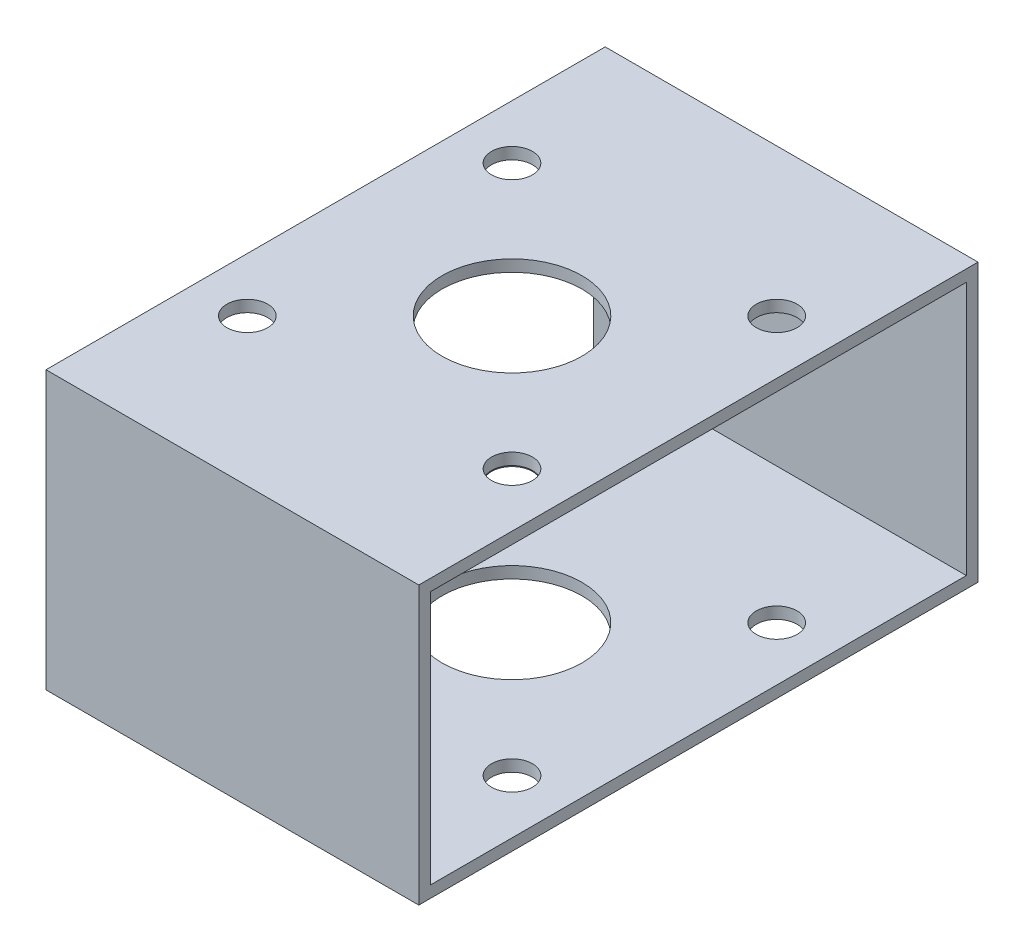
SolidWorks part; units mm, degrees
ref_plane "Front" through (0, 0, 0) normal (0, 0, 1) x (1, 0, 0)
ref_plane "Top" through (0, 0, 0) normal (0, 1, 0) x (1, 0, 0)
ref_plane "Right" through (0, 0, 0) normal (1, 0, 0) x (0, 0, -1)
sketch "Sketch1" plane through (0, 0, 0) normal (1, 0, 0) x (0, 0, -1)
  line L0 (-76.2, 37.7825) -> (76.2, -37.7825) construction
  line L1 (-76.2, 37.7825) -> (76.2, 37.7825)
  line L2 (-76.2, 37.7825) -> (-76.2, -37.7825)
  line L3 (-76.2, -37.7825) -> (76.2, -37.7825)
  line L4 (76.2, 37.7825) -> (76.2, -37.7825)
  dimension "D1" = 75.565
  dimension "D2" = 152.4
extrude "Extrude-Thin1" add sketch "Sketch1" along normal blind 50.8 and the other way blind 50.8 thin
sketch "Sketch2" plane through (0, 37.7825, 0) normal (0, 1, 0) x (-1, 0, 0)
  line L0 (-36.068, 36.068) -> (36.068, -36.068) construction
  line L1 (-36.068, 36.068) -> (36.068, 36.068) construction
  line L2 (-36.068, 36.068) -> (-36.068, -36.068) construction
  line L3 (-36.068, -36.068) -> (36.068, -36.068) construction
  line L4 (36.068, 36.068) -> (36.068, -36.068) construction
  circle A0 centre (0, 0) radius 19.05
  circle A1 centre (-36.068, 36.068) radius 5.5626
  circle A2 centre (36.068, 36.068) radius 5.5626
  circle A3 centre (36.068, -36.068) radius 5.5626
  circle A4 centre (-36.068, -36.068) radius 5.5626
  dimension "D1" = 38.1
  dimension "D2" = 11.1252
  dimension "D3" = 72.136
extrude "Cut-Extrude1" cut sketch "Sketch2" against normal up to next
sketch "Sketch3" plane through (0, -37.7825, 0) normal (0, -1, 0) x (1, 0, 0)
  line L0 (-36.068, 36.068) -> (36.068, -36.068) construction
  line L1 (-36.068, 36.068) -> (36.068, 36.068) construction
  line L2 (-36.068, 36.068) -> (-36.068, -36.068) construction
  line L3 (-36.068, -36.068) -> (36.068, -36.068) construction
  line L4 (36.068, 36.068) -> (36.068, -36.068) construction
  circle A0 centre (0, 0) radius 19.05
  circle A1 centre (-36.068, 36.068) radius 5.5626
  circle A2 centre (36.068, 36.068) radius 5.5626
  circle A3 centre (36.068, -36.068) radius 5.5626
  circle A4 centre (-36.068, -36.068) radius 5.5626
  dimension "D1" = 38.1
  dimension "D2" = 11.1252
  dimension "D3" = 72.136
extrude "Cut-Extrude2" cut sketch "Sketch3" against normal up to next
